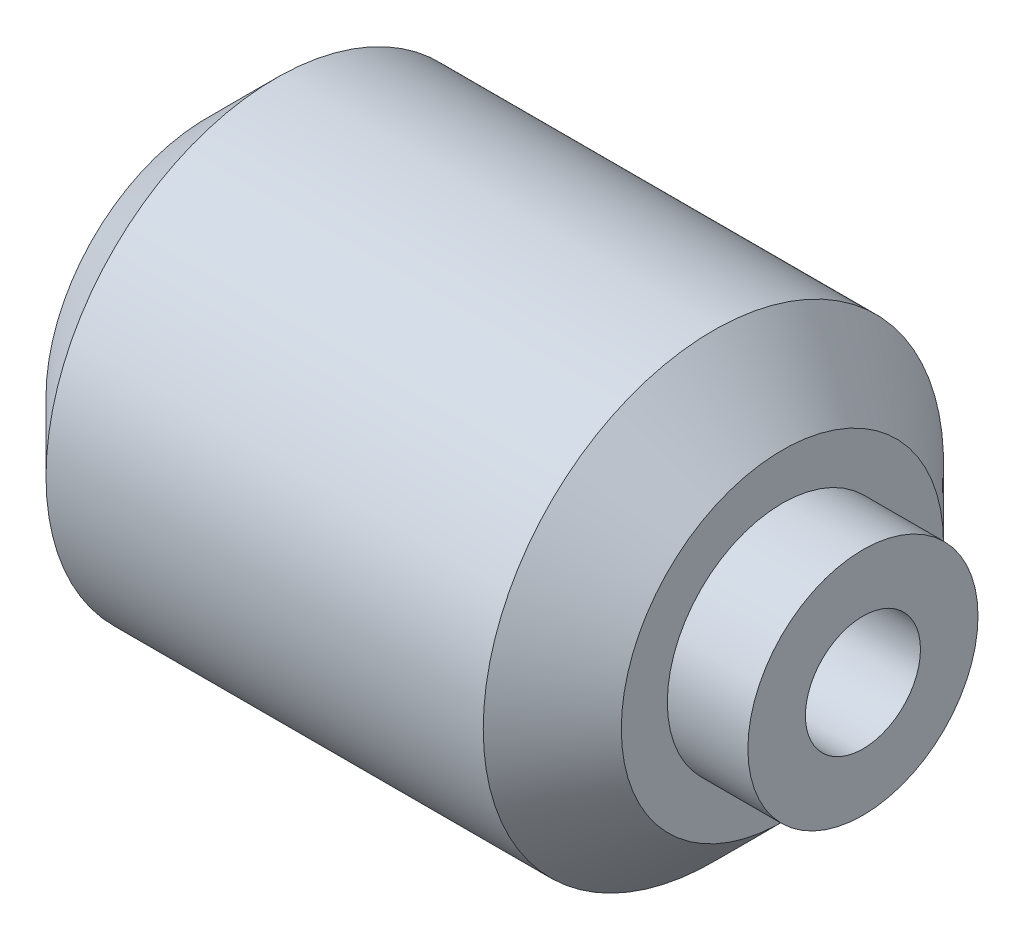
SolidWorks part; units mm, degrees
ref_plane "Front" through (0, 0, 0) normal (0, 0, 1) x (1, 0, 0)
ref_plane "Top" through (0, 0, 0) normal (0, 1, 0) x (1, 0, 0)
ref_plane "Right" through (0, 0, 0) normal (1, 0, 0) x (0, 0, -1)
sketch "Sketch1" plane through (0, 0, 0) normal (0, 1, 0) x (1, 0, 0)
  line L0 (0, 0) -> (28.5, 0)
  line L2 (25, 5) -> (28.5, 5)
  line L3 (3, 10) -> (22, 10)
  line L4 (0, 0) -> (0, 7)
  line L5 (28.5, 5) -> (28.5, 0)
  line L6 (25, 7) -> (25, 5)
  line L7 (28.5, 10) -> (28.5, 2.5) construction
  line L8 (0, 10) -> (28.5, 10) construction
  line L9 (25, 10) -> (25, 2.5) construction
  line L14 (0, 7) -> (3, 10)
  line L15 (22, 10) -> (25, 7)
revolve "Revolve1" add sketch "Sketch1" angle 360 about L0
sketch "Sketch2" plane through (28.5, 0, 0) normal (1, 0, 0) x (0, 0, -1)
  circle A0 centre (0, 0) radius 2.5
extrude "Cut-Extrude1" cut sketch "Sketch2" against normal through all
